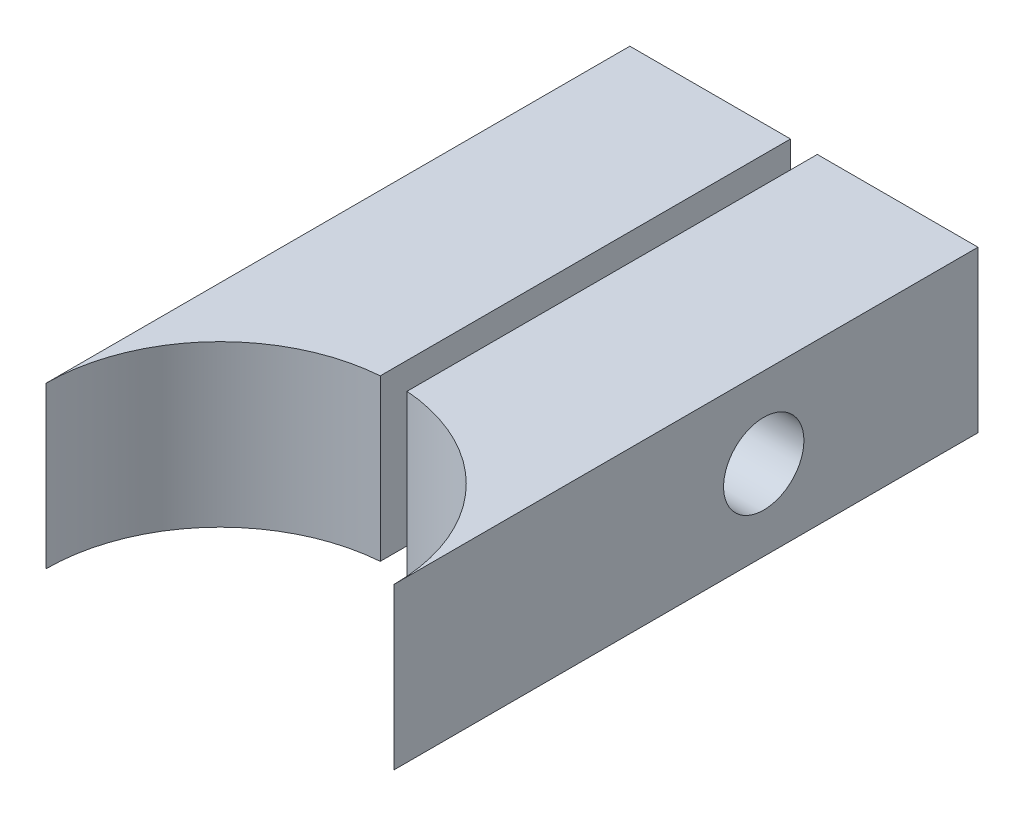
SolidWorks part; units mm, degrees
ref_plane "前视基准面" through (0, 0, 0) normal (0, 0, 1) x (1, 0, 0)
ref_plane "上视基准面" through (0, 0, 0) normal (0, 1, 0) x (1, 0, 0)
ref_plane "右视基准面" through (0, 0, 0) normal (1, 0, 0) x (0, 0, -1)
sketch "草图1" plane through (0, 0, 0) normal (0, 1, 0) x (1, 0, 0)
  line L0 (14.0289, -21.1643) -> (14.0289, 0.6355)
  line L1 (14.0289, 0.6355) -> (20.0289, 0.6355)
  line L2 (27.0289, -21.1643) -> (27.0289, 0.6355)
  line L3 (27.0289, 0.6355) -> (21.0289, 0.6355)
  line L4 (21.0289, 0.6355) -> (21.0289, -14.6836)
  line L5 (20.0289, 0.6355) -> (20.0289, -14.6836)
  arc A0 (20.0289, -14.6836) -> (14.0289, -21.1643) centre (20.5289, -21.1643) ccw
  arc A1 (27.0289, -21.1643) -> (21.0289, -14.6836) centre (20.5289, -21.1643) ccw
  dimension "D1" = 6
extrude "凸台-拉伸1" add sketch "草图1" along normal blind 6
sketch "草图2" plane through (27.0289, 0, 0) normal (1, 0, 0) x (0, 0, -1)
  line L0 (0.6355, 6) -> (0.6355, 0) construction
  circle A0 centre (-7.3645, 3) radius 1.5
  dimension "D1" = 8
extrude "切除-拉伸1" cut sketch "草图2" against normal blind 15
